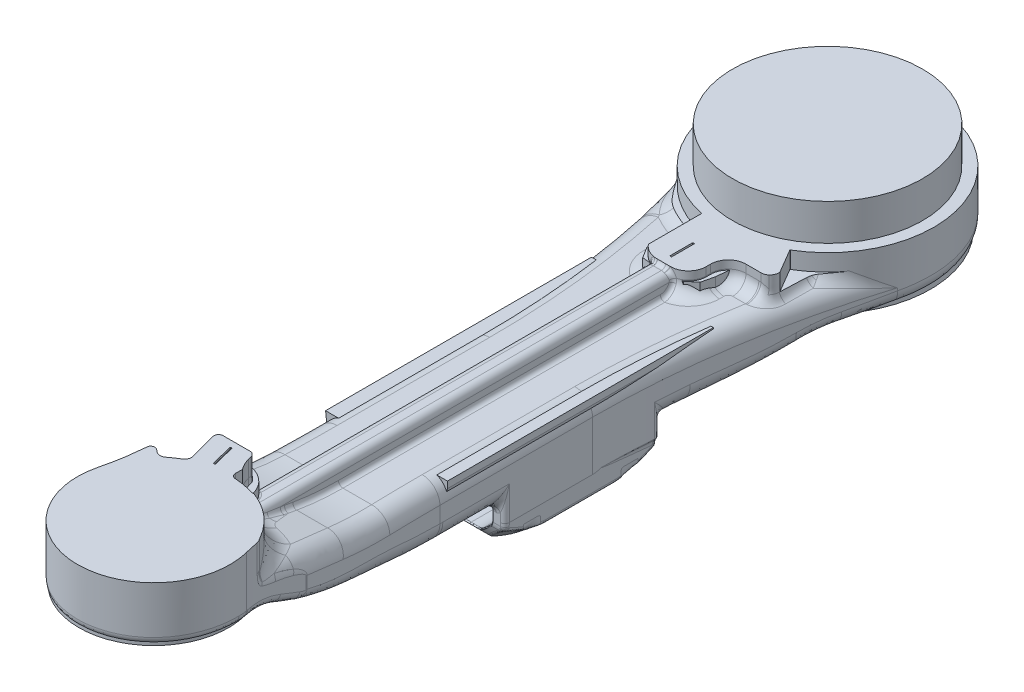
SolidWorks part; units mm, degrees
ref_plane "前视基准面" through (0, 0, 0) normal (0, 0, 1) x (1, 0, 0)
ref_plane "上视基准面" through (0, 0, 0) normal (0, 1, 0) x (1, 0, 0)
ref_plane "右视基准面" through (0, 0, 0) normal (1, 0, 0) x (0, 0, -1)
imported_body "输入1"
imported_body "输入2"
imported_body "输入4"
imported_body "输入5"
imported_body "输入6"
imported_body "输入7"
imported_body "输入9"
imported_body "输入10"
imported_body "输入11"
imported_body "输入12"
imported_body "输入14"
imported_body "输入15"
imported_body "输入16"
imported_body "输入17"
imported_body "输入18"
imported_body "输入20"
imported_body "输入21"
imported_body "输入23"
imported_body "输入24"
imported_body "输入25"
imported_body "输入26"
imported_body "输入27"
imported_body "输入28"
imported_body "输入29"
imported_body "输入30"
imported_body "输入31"
imported_body "输入32"
imported_body "输入33"
imported_body "输入34"
imported_body "输入35"
imported_body "输入36"
imported_body "输入37"
imported_body "输入38"
imported_body "输入39"
imported_body "输入40"
imported_body "输入41"
imported_body "输入42"
imported_body "输入44"
imported_body "输入45"
imported_body "输入47"
imported_body "输入48"
imported_body "输入49"
imported_body "输入50"
imported_body "输入51"
imported_body "输入52"
imported_body "输入53"
imported_body "输入54"
imported_body "输入55"
imported_body "输入56"
imported_body "输入57"
sketch "草图1" plane through (0, 0, 0) normal (1, 0, 0) x (0, 0, -1)
  line L0 (-1239.673, -162) -> (-1316.6931, -162) construction
  line L1 (-1364.7978, -162) -> (-1229.3503, -162)
  line L2 (-1530.5829, -162) -> (-1530.5829, -281.3814)
  line L3 (-1530.5829, -281.3814) -> (-1229.3503, -281.3814)
  line L4 (-1229.3503, -162) -> (-1229.3503, -281.3814)
  line L5 (-1530.5829, -162) -> (-1530.5829, -72.1976)
  line L6 (-1530.5829, -72.1976) -> (-1420.3511, -85.3205)
  line L7 (-1420.3511, -85.3205) -> (-1364.7978, -162)
extrude "切除-拉伸1" cut sketch "草图1" against normal through all both and the other way through all
